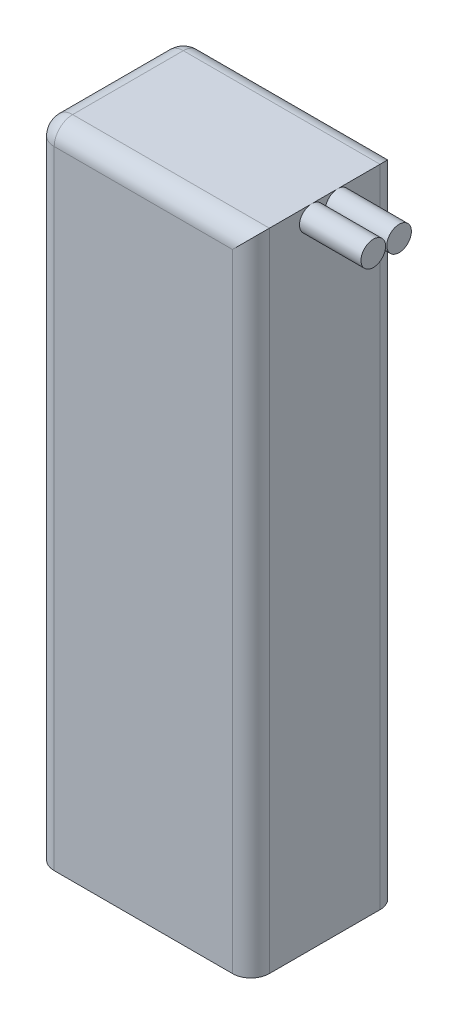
SolidWorks part; units mm, degrees
ref_plane "Front Plane" through (0, 0, 0) normal (0, 0, 1) x (1, 0, 0)
ref_plane "Top Plane" through (0, 0, 0) normal (0, 1, 0) x (1, 0, 0)
ref_plane "Right Plane" through (0, 0, 0) normal (1, 0, 0) x (0, 0, -1)
sketch "Sketch2" plane through (0, 0, 0) normal (0, 1, 0) x (1, 0, 0)
  line L1 (0, 0) -> (35, 0)
  line L2 (0, 0) -> (0, 24)
  line L3 (0, 24) -> (35, 24)
  line L4 (35, 0) -> (35, 24)
  dimension "35" = 35
  dimension "24" = 24
extrude "Boss-Extrude1" add sketch "Sketch2" along normal blind 105
sketch "Sketch5" plane through (35, 0, 0) normal (1, 0, 0) x (0, 0, -1)
  line L0 (24, 105) -> (24, 0) construction
  line L1 (0, 105) -> (0, 0) construction
  line L2 (0, 105) -> (24, 105) construction
  circle A0 centre (9.9, 103) radius 2
  circle A1 centre (14.1, 103) radius 2
  dimension "D1" = 4
  dimension "D2" = 4
  dimension "D3" = 9.9
  dimension "D4" = 9.9
extrude "Boss-Extrude2" add sketch "Sketch5" along normal blind 10
fillet "Fillet1" radius 3 7 edges at (0, 105, -12) (17.5, 105, -24) (0, 52.5, -24) (35, 52.5, -24) (0, 52.5, 0) (35, 52.5, 0) (17.5, 105, 0)
